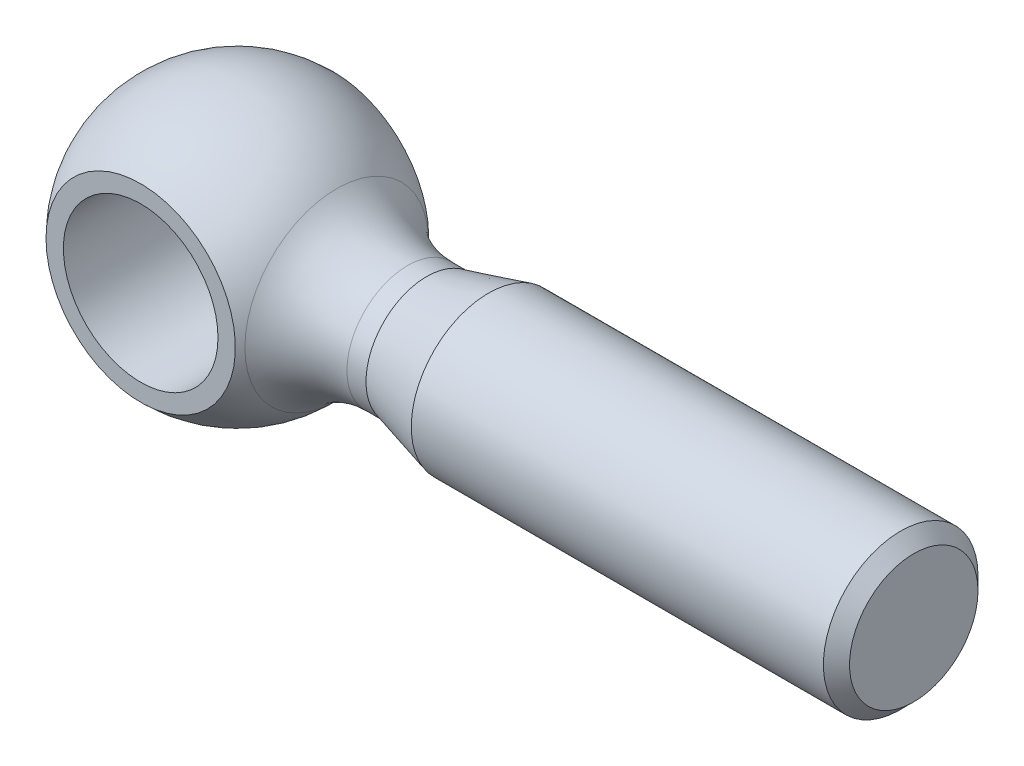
SolidWorks part; units mm, degrees
ref_plane "Front" through (0, 0, 0) normal (0, 0, 1) x (1, 0, 0)
ref_plane "Top" through (0, 0, 0) normal (0, 1, 0) x (1, 0, 0)
ref_plane "Right" through (0, 0, 0) normal (1, 0, 0) x (0, 0, -1)
sketch "Sketch2" plane through (0, 0, 0) normal (1, 0, 0) x (0, 0, -1)
  circle A0 centre (0, 0) radius 4
  dimension "d" = 8
extrude "BaseBody" add sketch "Sketch2" along normal blind 35 separate body
sketch "Sketch5" plane through (0, 0, 0) normal (0, 0, 1) x (1, 0, 0)
  line L0 (0, 3.1426) -> (9.8, 3.1426)
  line L1 (9.8, 3.1426) -> (13, 4)
  line L2 (35, 4) -> (0, 4) construction
  line L3 (13, 4) -> (0, 4)
  line L4 (0, 4) -> (0, 3.1426)
  line L5 (0, 4) -> (0, -4) construction
  dimension "D1" = 15
  dimension "X" = 3.2
  dimension "D3" = 13
revolve "Cut-Revolve1" cut sketch "Sketch5" angle 360 about axis through (35, 0, 0) along (-1, 0, 0)
sketch "Sketch1" plane through (0.9567, 0, -6.0433) normal (0, 1, 0) x (0, 0, -1)
  line L0 (-13.0433, 0.9567) -> (0.9567, 0.9567)
  line L1 (-19.3915, 0.9567) -> (2.2184, 0.9567) construction
  arc A0 (0.9567, 0.9567) -> (-13.0433, 0.9567) centre (-6.0433, 0.9567) ccw
  dimension "SD" = 14
revolve "BaseHead" add sketch "Sketch1" angle 360 about L1
sketch "Sketch3" plane through (0, 0, 0) normal (1, 0, 0) x (0, 0, -1)
  line L0 (-5, 4.899) -> (-5, -4.899)
  line L1 (5, 4.899) -> (5, -4.899)
  arc A1 (-5, 4.899) -> (-5, -4.899) centre (0, 0) ccw
  arc A2 (5, -4.899) -> (5, 4.899) centre (0, 0) ccw
  dimension "s" = 10
  dimension "D2" = 5
extrude "Cut-Extrude1" cut sketch "Sketch3" against normal through all and the other way through all
sketch "Sketch4" plane through (0, 0, 5) normal (0, 0, 1) x (1, 0, 0)
  circle A0 centre (0, 0) radius 4
  dimension "d1" = 8
extrude "Hole" cut sketch "Sketch4" against normal through all
chamfer "Chamfer1" distance 0.6765 angle 45 1 edges at (35, 0, -4)
fillet "HeadFillet" radius 5 1 edges at (6.2549, 0, 3.1426)
sketch "Sketch6" plane through (0, 0, 0) normal (0, 0, 1) x (1, 0, 0)
  line L0 (33.647, 4.6765) -> (34.3235, 4.6765)
  line L1 (34.3235, 4.6765) -> (34.3235, 4)
  line L2 (34.3235, 4) -> (33.9853, 3.4141)
  line L3 (33.9853, 3.4141) -> (33.647, 4)
  line L4 (33.647, 4) -> (33.647, 4.6765)
  line L5 (34.3235, -4) -> (34.3235, 4) construction
  line L6 (34.3235, 4) -> (13, 4) construction
  dimension "D1" = 0.6765
revolve "Cut-Revolve10" [suppressed] cut sketch "Sketch6" angle 360
pattern_linear "LPattern10" [suppressed] count 27
equation "\"D2@Sketch3\" = \"s@Sketch3\" / 2"
equation "\"C1@Chamfer1\" =  (\"d@Sketch2\" - \"D2@ThreadCosmetic1\" )  / 2"
equation "\"D3@Sketch5\" = \"l@BaseBody\" - \"b@ThreadCosmetic1\""
equation "\"D1@Sketch6\" =  ( \"d@Sketch2\" - \"D2@ThreadCosmetic1\" )  / 2"
equation "\"pitch@LPattern10\" = 1.2 * \"D1@Sketch6\""
equation "\"D1@LPattern10\" = \"b@ThreadCosmetic1\" / \"pitch@LPattern10\""
